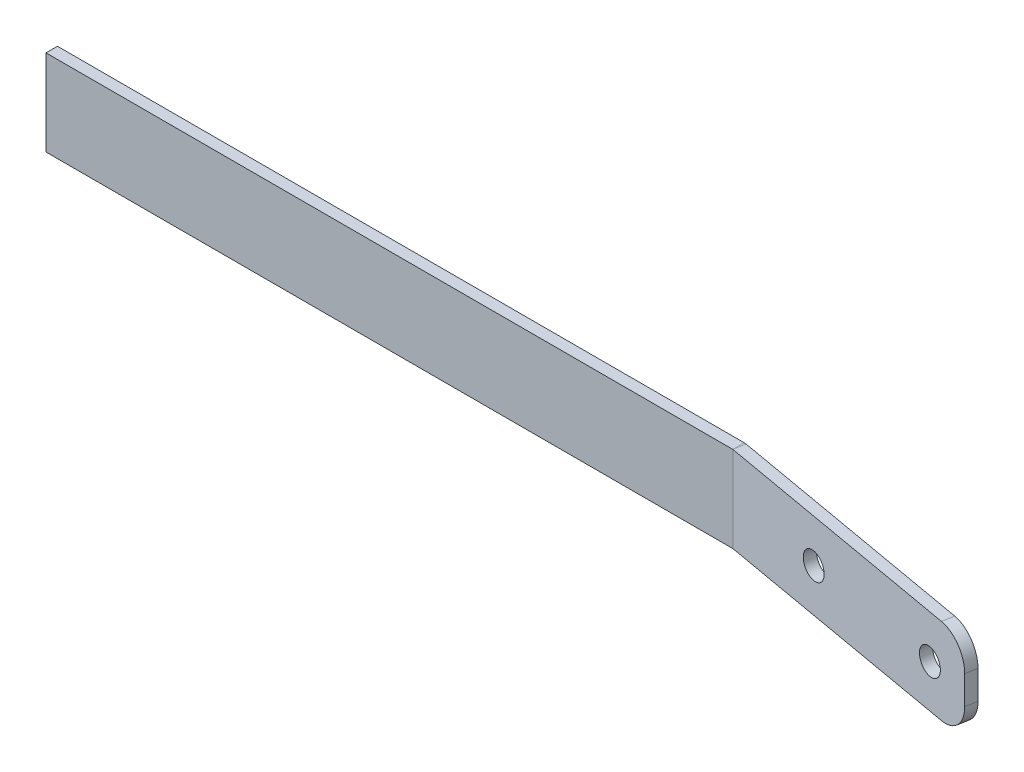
SolidWorks part; units mm, degrees
ref_plane "Plan1" through (0, 0, 0) normal (0, 0, 1) x (1, 0, 0)
ref_plane "Plan2" through (0, 0, 0) normal (0, 1, 0) x (1, 0, 0)
ref_plane "Plan3" through (0, 0, 0) normal (1, 0, 0) x (0, 0, -1)
sketch "Esquisse1" plane through (0, 0, 0) normal (0, 0, 1) x (1, 0, 0)
  line L0 (-325, 15) -> (5, 15)
  line L1 (-325, 15) -> (-325, -15)
  line L2 (5, -15) -> (-325, -15)
  line L3 (15, -5) -> (15, 5)
  arc A0 (5, 15) -> (15, 5) centre (5, 5) cw
  arc A1 (5, -15) -> (15, -5) centre (5, -5) ccw
  circle A2 centre (0, 0) radius 4.5
  circle A3 centre (-50, 0) radius 4.5
  point P7 (0, 15)
  point P10 (0, -15)
  point P17 (-181.3546, 5.1564)
  dimension "D4" = 90
  dimension "D5" = 10
  dimension "D6" = 9
  dimension "D1" = 15
  dimension "D2" = 340
  dimension "D3" = 30
  dimension "D7" = 50
extrude "Base-Extrusion" add sketch "Esquisse1" along normal mid plane 4
sheet metal parameters "Tôlerie 1" parameters "D1"=0, "Epaisseur"=4
flatten bends "Dépliage 1" parameters "D1"=0
sketch "Esquisse-Angle1" plane through (0, 0, 2) normal (0, 0, 1) x (1, 0, 0)
process bends "Pliage 1" parameters "D1"=0
sketch "Esquisse-Plate1" plane through (0, 0, 2) normal (0, 0, 1) x (1, 0, 0)
  line L0 (-85, 15.0833) -> (-85, -15.0898) construction
  line L1 (15, -5) -> (15, 5) construction
  point P4 (-91, 0)
  dimension "D1" = 100
bend "Pli défini à plat1" bend angle 10 parameters "D1"=0, "D5"=1
